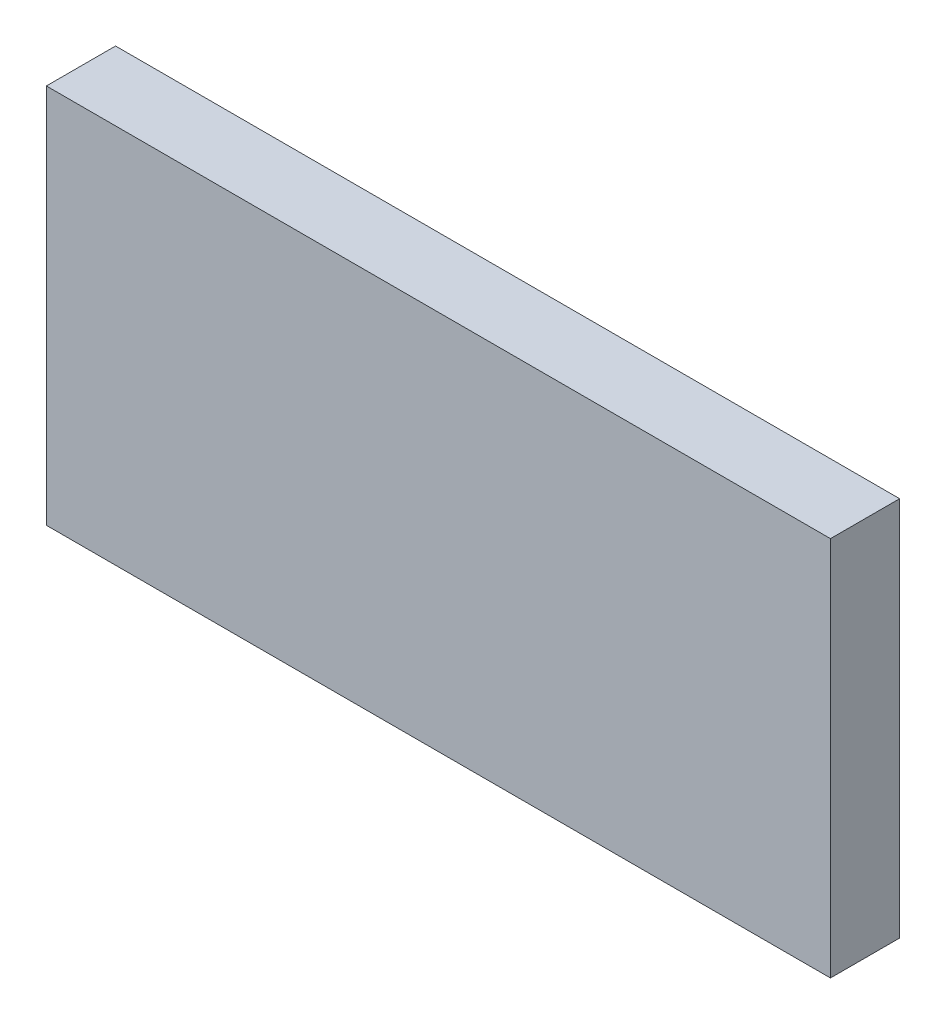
SolidWorks part; units mm, degrees
ref_plane "Plan de face" through (0, 0, 0) normal (0, 0, 1) x (1, 0, 0)
ref_plane "Plan de dessus" through (0, 0, 0) normal (0, 1, 0) x (1, 0, 0)
ref_plane "Plan de droite" through (0, 0, 0) normal (1, 0, 0) x (0, 0, -1)
sketch "Esquisse1" plane through (0, 0, 0) normal (0, 0, 1) x (1, 0, 0)
  line L1 (0, 0) -> (68, 0)
  line L2 (0, 0) -> (0, 33)
  line L3 (0, 33) -> (68, 33)
  line L4 (68, 0) -> (68, 33)
extrude "Extrusion1" add sketch "Esquisse1" along normal blind 6
